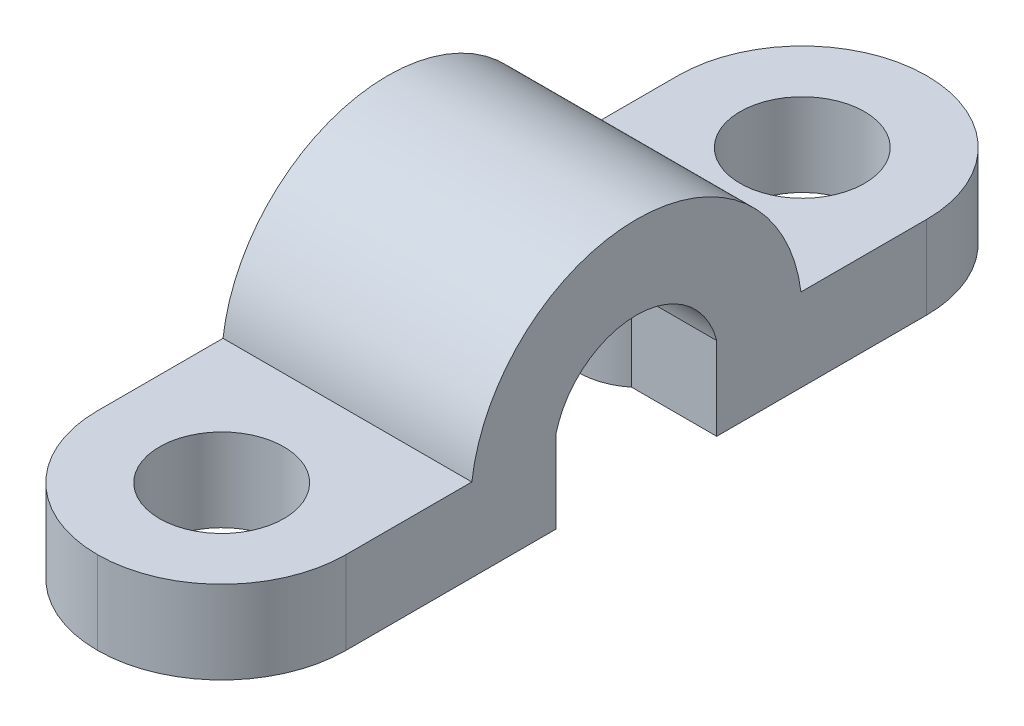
SolidWorks part; units mm, degrees
ref_plane "Plan de face" through (0, 0, 0) normal (0, 0, 1) x (1, 0, 0)
ref_plane "Plan de dessus" through (0, 0, 0) normal (0, 1, 0) x (1, 0, 0)
ref_plane "Plan de droite" through (0, 0, 0) normal (1, 0, 0) x (0, 0, -1)
sketch "Esquisse1" plane through (0, 0, 0) normal (0, 0, 1) x (1, 0, 0)
  line L0 (0, 35.5273) -> (0, -31.3166) construction
  line L1 (-22.5445, 0) -> (24.2989, 0) construction
  line L2 (-1.5, 3.1) -> (1.5, 3.1)
  arc A0 (-1.5, 3.1) -> (1.5, 3.1) centre (0, 3.1) ccw
revolve "Révolution1" add sketch "Esquisse1" angle 360 about L1
sketch "Esquisse2" plane through (0, 0, 0) normal (0, 0, 1) x (1, 0, 0)
  line L1 (-4.9351, -4.9116) -> (3.8436, -4.9116)
  line L2 (-4.9351, -4.9116) -> (-4.9351, 0)
  line L3 (-4.9351, 0) -> (3.8436, 0)
  line L4 (3.8436, -4.9116) -> (3.8436, 0)
extrude "Enlèv. mat.-Extru.1" cut sketch "Esquisse2" against normal mid plane 10
sketch "Esquisse3" plane through (0, 0, 0) normal (1, 0, 0) x (0, 0, -1)
  line L0 (-10, -1.5) -> (-1.9365, -1.5)
  line L1 (-8.6542, 0) -> (9.0829, 0) construction
  line L2 (-10, 0.5) -> (-3.9686, 0.5)
  line L3 (4, 4.094) -> (4, -6.1736) construction
  line L4 (7, 3.1011) -> (7, -4.075) construction
  line L5 (10, 4.094) -> (10, -5.632) construction
  line L6 (3.9686, 0.5) -> (10, 0.5)
  line L7 (-10, 3.8154) -> (-10, -4.6654) construction
  line L8 (10, 0.5) -> (10, -1.5)
  line L9 (-10, 0.5) -> (-10, -1.5)
  line L10 (-5.572, 0.5) -> (-1.0822, 0.5) construction
  line L11 (1.9365, 0.5) -> (1.9365, -1.5)
  line L12 (-1.9365, 0.5) -> (-1.9365, -1.5)
  line L13 (1.9365, -1.5) -> (10, -1.5)
  arc A0 (1.9365, 0.5) -> (-1.9365, 0.5) centre (0, 0) ccw
  arc A1 (3.9686, 0.5) -> (-3.9686, 0.5) centre (0, 0) ccw
extrude "Extrusion1" add sketch "Esquisse3" along normal mid plane 6
sketch "Esquisse4" plane through (0, 0, 0) normal (0, 1, 0) x (1, 0, 0)
  line L0 (-3.4581, 3.1) -> (4.5215, 3.1) construction
  line L1 (-1.619, 0) -> (2.1497, 0) construction
  circle A1 centre (0, 3.1) radius 1.5
  circle A2 centre (0, -3.1) radius 1.5
extrude "Extrusion2" add sketch "Esquisse4" against normal blind 1.5
sketch "Esquisse5" plane through (0, 0.5, 0) normal (0, 1, 0) x (-1, 0, 0)
  line L0 (0, -11.1685) -> (0, 12.6669) construction
  line L1 (-5.1949, 0) -> (6.1215, 0) construction
  line L2 (-4.5246, 7) -> (5.6878, 7) construction
  circle A0 centre (0, 7) radius 1.5
  circle A1 centre (0, -7) radius 1.5
extrude "Enlèv. mat.-Extru.2" cut sketch "Esquisse5" against normal through all
fillet "Congé1" radius 3 8 edges at (-3, -0.5, -10) (0, -1.5, -10) (0, 0.5, -10) (-3, -0.5, 10) (0, 0.5, 10) (0, -1.5, 10) (3, -0.5, -10) (3, -0.5, 10)
